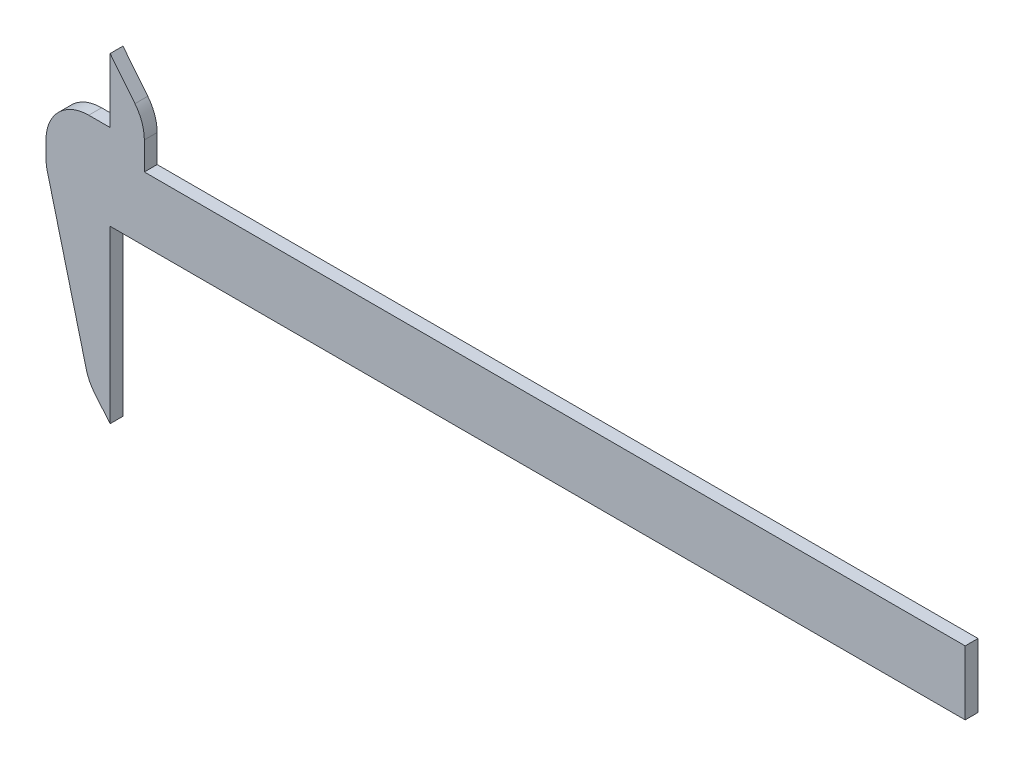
SolidWorks part; units mm, degrees
ref_plane "Plan de face" through (0, 0, 0) normal (0, 0, 1) x (1, 0, 0)
ref_plane "Plan de dessus" through (0, 0, 0) normal (0, 1, 0) x (1, 0, 0)
ref_plane "Plan de droite" through (0, 0, 0) normal (1, 0, 0) x (0, 0, -1)
sketch "Esquisse1" plane through (0, 0, 0) normal (0, 0, 1) x (1, 0, 0)
  line L0 (0, 0) -> (200, 0)
  line L1 (200, 0) -> (200, 15)
  line L2 (200, 15) -> (8, 15)
  line L3 (8, 15) -> (8, 25)
  line L4 (8, 25) -> (0, 35)
  line L5 (0, 35) -> (0, 20)
  line L6 (0, 20) -> (-15, 20)
  line L7 (-15, 20) -> (-15, 5)
  line L8 (-15, 5) -> (-5, -34)
  line L9 (-5, -34) -> (0, -40)
  line L10 (0, -40) -> (0, 0)
  dimension "D1" = 200
  dimension "D2" = 40
  dimension "D3" = 20
  dimension "D4" = 15
  dimension "D5" = 8
  dimension "D6" = 10
  dimension "D7" = 5
  dimension "D8" = 15
  dimension "D9" = 15
  dimension "D10" = 6
  dimension "D11" = 5
extrude "Boss.-Extru.1" add sketch "Esquisse1" along normal blind 3
sketch "Esquisse2" plane through (0, 0, 3) normal (0, 0, 1) x (1, 0, 0)
  line L0 (10, 3) -> (10, 8)
  line L1 (11, 3) -> (11, 6)
  line L2 (12, 3) -> (12, 6)
  line L3 (13, 3) -> (13, 6)
  line L4 (14, 3) -> (14, 6)
  line L5 (15, 3) -> (15, 8)
  line L6 (16, 3) -> (16, 6)
  line L7 (17, 3) -> (17, 6)
  line L8 (18, 3) -> (18, 6)
  line L9 (19, 3) -> (19, 6)
  line L10 (235.3559, 2) -> (245.9593, 2) construction
  line L11 (20, 3) -> (20, 8)
  line L12 (21, 3) -> (21, 6)
  line L13 (22, 3) -> (22, 6)
  line L14 (23, 3) -> (23, 6)
  line L15 (24, 3) -> (24, 6)
  line L16 (25, 3) -> (25, 8)
  line L17 (26, 3) -> (26, 6)
  line L18 (27, 3) -> (27, 6)
  line L19 (28, 3) -> (28, 6)
  line L20 (29, 3) -> (29, 6)
  line L21 (30, 3) -> (30, 8)
  line L22 (31, 3) -> (31, 6)
  line L23 (32, 3) -> (32, 6)
  line L24 (33, 3) -> (33, 6)
  line L25 (34, 3) -> (34, 6)
  line L26 (35, 3) -> (35, 8)
  line L27 (36, 3) -> (36, 6)
  line L28 (37, 3) -> (37, 6)
  line L29 (38, 3) -> (38, 6)
  line L30 (39, 3) -> (39, 6)
  line L31 (40, 3) -> (40, 8)
  line L32 (41, 3) -> (41, 6)
  line L33 (42, 3) -> (42, 6)
  line L34 (43, 3) -> (43, 6)
  line L35 (44, 3) -> (44, 6)
  line L36 (45, 3) -> (45, 8)
  line L37 (46, 3) -> (46, 6)
  line L38 (47, 3) -> (47, 6)
  line L39 (48, 3) -> (48, 6)
  line L40 (49, 3) -> (49, 6)
  line L41 (50, 3) -> (50, 8)
  line L42 (51, 3) -> (51, 6)
  line L43 (52, 3) -> (52, 6)
  line L44 (53, 3) -> (53, 6)
  line L45 (54, 3) -> (54, 6)
  line L46 (55, 3) -> (55, 8)
  line L47 (56, 3) -> (56, 6)
  line L48 (57, 3) -> (57, 6)
  line L49 (58, 3) -> (58, 6)
  line L50 (59, 3) -> (59, 6)
  line L51 (60, 3) -> (60, 8)
  line L52 (61, 3) -> (61, 6)
  line L53 (62, 3) -> (62, 6)
  line L54 (63, 3) -> (63, 6)
  line L55 (64, 3) -> (64, 6)
  line L56 (65, 3) -> (65, 8)
  line L57 (66, 3) -> (66, 6)
  line L58 (67, 3) -> (67, 6)
  line L59 (68, 3) -> (68, 6)
  line L60 (69, 3) -> (69, 6)
  line L61 (70, 3) -> (70, 8)
  line L62 (71, 3) -> (71, 6)
  line L63 (72, 3) -> (72, 6)
  line L64 (73, 3) -> (73, 6)
  line L65 (74, 3) -> (74, 6)
  line L66 (75, 3) -> (75, 8)
  line L67 (76, 3) -> (76, 6)
  line L68 (77, 3) -> (77, 6)
  line L69 (78, 3) -> (78, 6)
  line L70 (79, 3) -> (79, 6)
  line L71 (80, 3) -> (80, 8)
  line L72 (81, 3) -> (81, 6)
  line L73 (82, 3) -> (82, 6)
  line L74 (83, 3) -> (83, 6)
  line L75 (84, 3) -> (84, 6)
  line L76 (85, 3) -> (85, 8)
  line L77 (86, 3) -> (86, 6)
  line L78 (87, 3) -> (87, 6)
  line L79 (88, 3) -> (88, 6)
  line L80 (89, 3) -> (89, 6)
  line L81 (90, 3) -> (90, 8)
  line L82 (91, 3) -> (91, 6)
  line L83 (92, 3) -> (92, 6)
  line L84 (93, 3) -> (93, 6)
  line L85 (94, 3) -> (94, 6)
  line L86 (95, 3) -> (95, 8)
  line L87 (96, 3) -> (96, 6)
  line L88 (97, 3) -> (97, 6)
  line L89 (98, 3) -> (98, 6)
  line L90 (99, 3) -> (99, 6)
  line L91 (100, 3) -> (100, 8)
  line L92 (101, 3) -> (101, 6)
  line L93 (102, 3) -> (102, 6)
  line L94 (103, 3) -> (103, 6)
  line L95 (104, 3) -> (104, 6)
  line L96 (105, 3) -> (105, 8)
  line L97 (106, 3) -> (106, 6)
  line L98 (107, 3) -> (107, 6)
  line L99 (108, 3) -> (108, 6)
  line L100 (109, 3) -> (109, 6)
  line L101 (110, 3) -> (110, 8)
  line L102 (111, 3) -> (111, 6)
  line L103 (112, 3) -> (112, 6)
  line L104 (113, 3) -> (113, 6)
  line L105 (114, 3) -> (114, 6)
  line L106 (115, 3) -> (115, 8)
  line L107 (116, 3) -> (116, 6)
  line L108 (117, 3) -> (117, 6)
  line L109 (118, 3) -> (118, 6)
  line L110 (119, 3) -> (119, 6)
  line L111 (120, 3) -> (120, 8)
  line L112 (121, 3) -> (121, 6)
  line L113 (122, 3) -> (122, 6)
  line L114 (123, 3) -> (123, 6)
  line L115 (124, 3) -> (124, 6)
  line L116 (125, 3) -> (125, 8)
  line L117 (126, 3) -> (126, 6)
  line L118 (127, 3) -> (127, 6)
  line L119 (128, 3) -> (128, 6)
  line L120 (129, 3) -> (129, 6)
  line L121 (130, 3) -> (130, 8)
  line L122 (131, 3) -> (131, 6)
  line L123 (132, 3) -> (132, 6)
  line L124 (133, 3) -> (133, 6)
  line L125 (134, 3) -> (134, 6)
  line L126 (135, 3) -> (135, 8)
  line L127 (136, 3) -> (136, 6)
  line L128 (137, 3) -> (137, 6)
  line L129 (138, 3) -> (138, 6)
  line L130 (139, 3) -> (139, 6)
  line L131 (140, 3) -> (140, 8)
  line L132 (141, 3) -> (141, 6)
  line L133 (142, 3) -> (142, 6)
  line L134 (143, 3) -> (143, 6)
  line L135 (144, 3) -> (144, 6)
  line L136 (145, 3) -> (145, 8)
  line L137 (146, 3) -> (146, 6)
  line L138 (147, 3) -> (147, 6)
  line L139 (148, 3) -> (148, 6)
  line L140 (149, 3) -> (149, 6)
  line L141 (150, 3) -> (150, 8)
  line L142 (151, 3) -> (151, 6)
  line L143 (152, 3) -> (152, 6)
  line L144 (153, 3) -> (153, 6)
  line L145 (154, 3) -> (154, 6)
  line L146 (155, 3) -> (155, 8)
  line L147 (156, 3) -> (156, 6)
  line L148 (157, 3) -> (157, 6)
  line L149 (158, 3) -> (158, 6)
  line L150 (159, 3) -> (159, 6)
  line L151 (160, 3) -> (160, 8)
  line L152 (161, 3) -> (161, 6)
  line L153 (162, 3) -> (162, 6)
  line L154 (163, 3) -> (163, 6)
  line L155 (164, 3) -> (164, 6)
  line L156 (165, 3) -> (165, 8)
  line L157 (166, 3) -> (166, 6)
  line L158 (167, 3) -> (167, 6)
  line L159 (168, 3) -> (168, 6)
  line L160 (169, 3) -> (169, 6)
  line L161 (170, 3) -> (170, 8)
  line L162 (171, 3) -> (171, 6)
  line L163 (172, 3) -> (172, 6)
  line L164 (173, 3) -> (173, 6)
  line L165 (174, 3) -> (174, 6)
  line L166 (175, 3) -> (175, 8)
  line L167 (176, 3) -> (176, 6)
  line L168 (177, 3) -> (177, 6)
  line L169 (178, 3) -> (178, 6)
  line L170 (179, 3) -> (179, 6)
  line L171 (180, 3) -> (180, 8)
  line L172 (181, 3) -> (181, 6)
  line L173 (182, 3) -> (182, 6)
  line L174 (183, 3) -> (183, 6)
  line L175 (184, 3) -> (184, 6)
  line L176 (185, 3) -> (185, 8)
  line L177 (186, 3) -> (186, 6)
  line L178 (187, 3) -> (187, 6)
  line L179 (188, 3) -> (188, 6)
  line L180 (189, 3) -> (189, 6)
  line L182 (0, -40) -> (0, 0) construction
  dimension "D1" = 5
  dimension "D2" = 3
  dimension "D3" = 5
  dimension "D4" = 1
  dimension "D5" = 1
  dimension "D6" = 1
  dimension "D7" = 1
  dimension "D8" = 1
  dimension "D9" = 1
  dimension "D10" = 1
  dimension "D11" = 1
  dimension "D12" = 1
  dimension "D13" = 1
  dimension "D15" = 10
  dimension "D14" = 18
sketch "Esquisse3" plane through (0, 0, 3) normal (0, 0, 1) x (1, 0, 0)
  text T0 "0      1     2     3      4     5     6      7      8     9    10    11   12    13   14   15  "
fillet "Congé1" radius 10 3 edges at (-15, 5, 1.5) (-5, -34, 1.5) (-15, 20, 1.5)
fillet "Congé2" radius 10 1 edges at (8, 25, 1.5)
